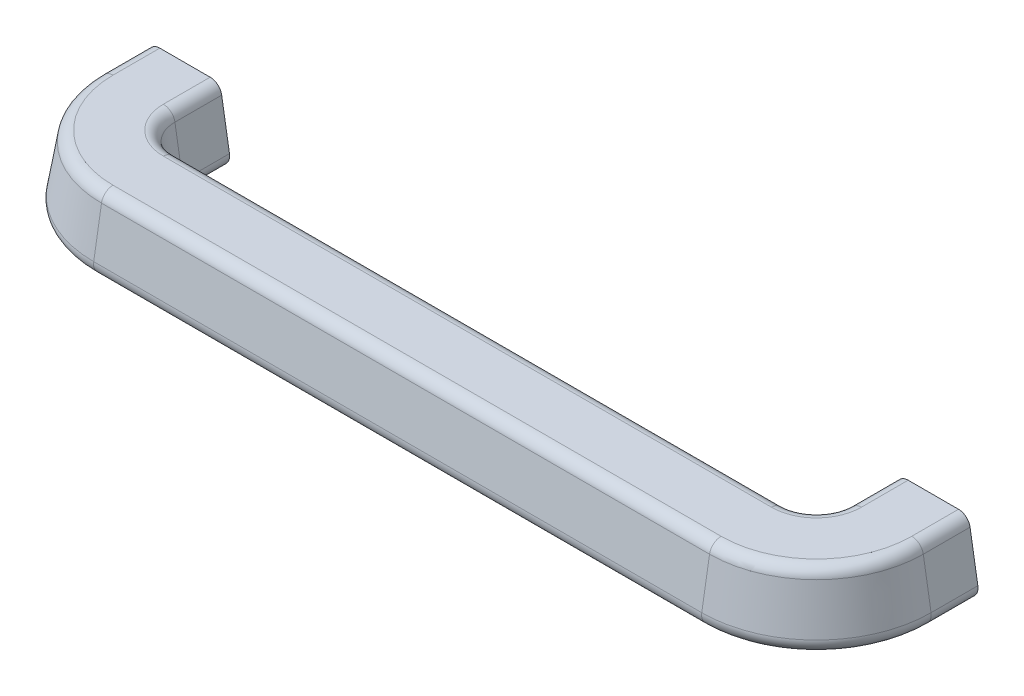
SolidWorks part; units mm, degrees
ref_plane "Front Plane" through (0, 0, 0) normal (0, 0, 1) x (1, 0, 0)
ref_plane "Top Plane" through (0, 0, 0) normal (0, 1, 0) x (1, 0, 0)
ref_plane "Right Plane" through (0, 0, 0) normal (1, 0, 0) x (0, 0, -1)
sketch "Sketch1" plane through (0, 0, 0) normal (0, 1, 0) x (1, 0, 0)
  line L0 (-165.1, 0) -> (165.1, 0)
  line L1 (-203.2, 38.1) -> (-203.2, 63.5)
  line L2 (203.2, 38.1) -> (203.2, 63.5)
  arc A0 (-165.1, 0) -> (-203.2, 38.1) centre (-165.1, 38.1) cw
  arc A1 (165.1, 0) -> (203.2, 38.1) centre (165.1, 38.1) ccw
  point P6 (-203.2, 0)
  point P9 (203.2, 0)
  dimension "D2" = 38.1
  dimension "D1" = 406.4
  dimension "D3" = 63.5
ref_plane "Plane1" through (203.2, 0, -63.5) normal (0, 0, -1) x (-1, 0, 0)
sketch "Sketch2" plane through (203.2, 0, -63.5) normal (0, 0, -1) x (-1, 0, 0)
  line L0 (-13.6707, 19.05) -> (13.6707, 19.05)
  line L1 (-17.9041, -19.05) -> (17.9041, -19.05)
  line L2 (24.1677, -11.6561) -> (19.9343, 13.7439)
  line L3 (-19.9343, 13.7439) -> (-24.1677, -11.6561)
  line L4 (0, 19.05) -> (0, -19.05) construction
  line L6 (-12.7, -12.7) -> (12.7, -12.7)
  line L7 (-12.7, -12.7) -> (-12.7, 12.7)
  line L8 (-12.7, 12.7) -> (12.7, 12.7)
  line L9 (12.7, -12.7) -> (12.7, 12.7)
  line L10 (-12.7, -12.7) -> (12.7, 12.7) construction
  line L11 (-12.7, 12.7) -> (12.7, -12.7) construction
  arc A0 (-13.6707, 19.05) -> (-19.9343, 13.7439) centre (-13.6707, 12.7) ccw
  arc A1 (13.6707, 19.05) -> (19.9343, 13.7439) centre (13.6707, 12.7) cw
  arc A2 (17.9041, -19.05) -> (24.1677, -11.6561) centre (17.9041, -12.7) ccw
  arc A3 (-17.9041, -19.05) -> (-24.1677, -11.6561) centre (-17.9041, -12.7) cw
  point P8 (-19.05, 19.05)
  point P11 (19.05, 19.05)
  point P14 (25.4, -19.05)
  point P17 (-25.4, -19.05)
  point P19 (0, 0)
  dimension "D4" = 6.35
  dimension "D1" = 38.1
  dimension "D2" = 50.8
  dimension "D3" = 38.1
  dimension "D5" = 25.4
sweep "Sweep1" add profiles "Sketch2" path "Sketch1"
